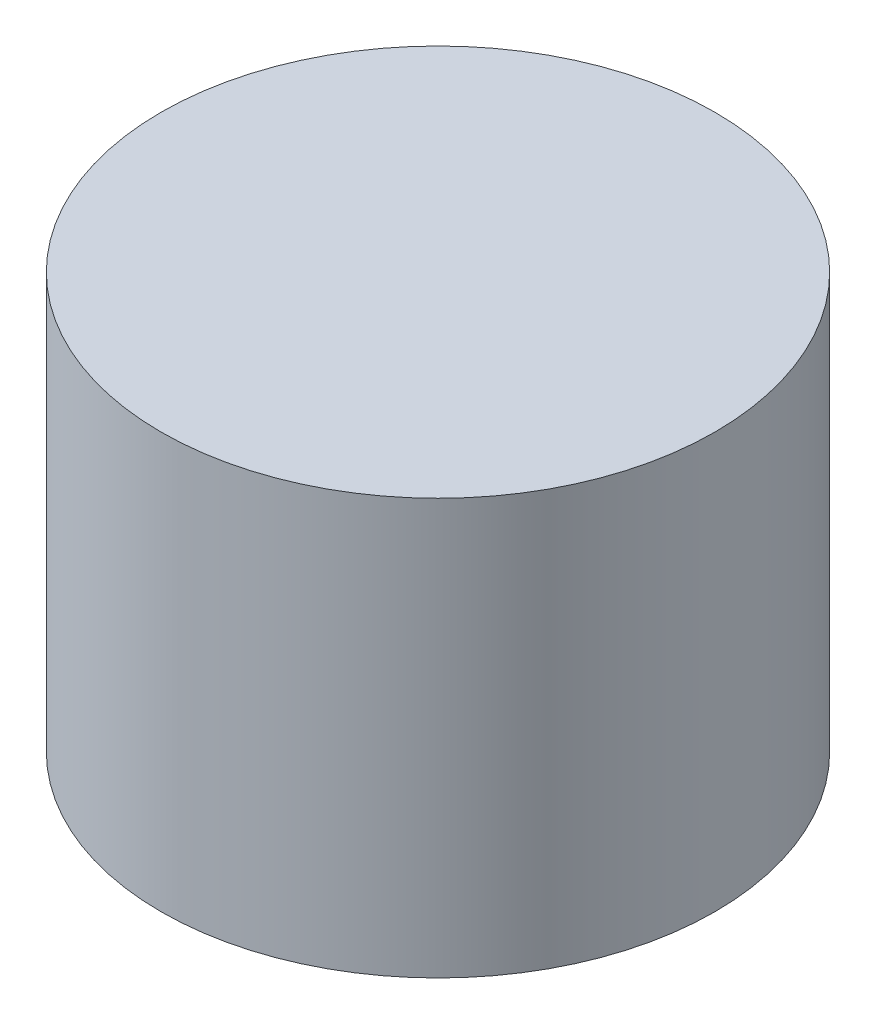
SolidWorks part; units mm, degrees
ref_plane "Front Plane" through (0, 0, 0) normal (0, 0, 1) x (1, 0, 0)
ref_plane "Top Plane" through (0, 0, 0) normal (0, 1, 0) x (1, 0, 0)
ref_plane "Right Plane" through (0, 0, 0) normal (1, 0, 0) x (0, 0, -1)
sketch "Sketch1" plane through (0, 0, 0) normal (0, 1, 0) x (1, 0, 0)
  circle A0 centre (0, 0) radius 4
  dimension "D1" = 8
extrude "Extrude1" add sketch "Sketch1" along normal blind 6
